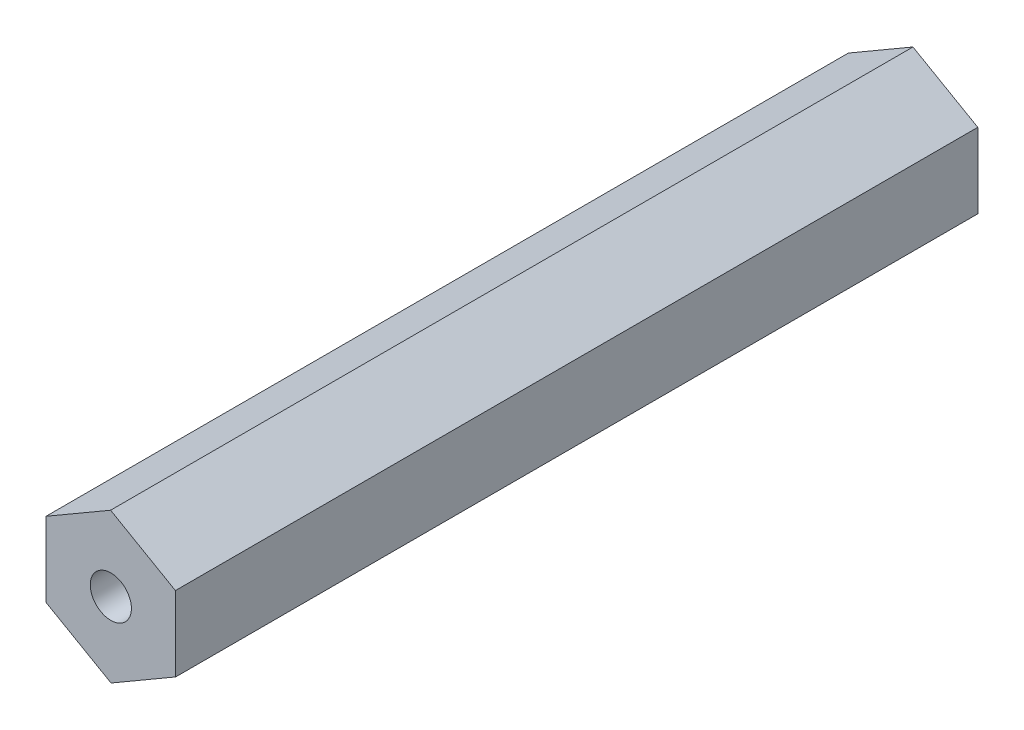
SolidWorks part; units mm, degrees
ref_plane "Front Plane" through (0, 0, 0) normal (0, 0, 1) x (1, 0, 0)
ref_plane "Top Plane" through (0, 0, 0) normal (0, 1, 0) x (1, 0, 0)
ref_plane "Right Plane" through (0, 0, 0) normal (1, 0, 0) x (0, 0, -1)
sketch "Sketch1" plane through (0, 0, 0) normal (0, 0, 1) x (1, 0, 0)
  line L1 (6.3611, -3.6469) -> (6.3388, 3.6854)
  line L2 (6.3388, 3.6854) -> (-0.0222, 7.3323)
  line L3 (-0.0222, 7.3323) -> (-6.3611, 3.6469)
  line L4 (-6.3611, 3.6469) -> (-6.3388, -3.6854)
  line L5 (-6.3388, -3.6854) -> (0.0222, -7.3323)
  line L6 (0.0222, -7.3323) -> (6.3611, -3.6469)
  circle A0 centre (0, 0) radius 6.35 construction
  circle A1 centre (0, 0) radius 2.0193
  dimension "D2" = 4.0386
  dimension "D1" = 12.7
extrude "Boss-Extrude1" add sketch "Sketch1" along normal blind 78.74
